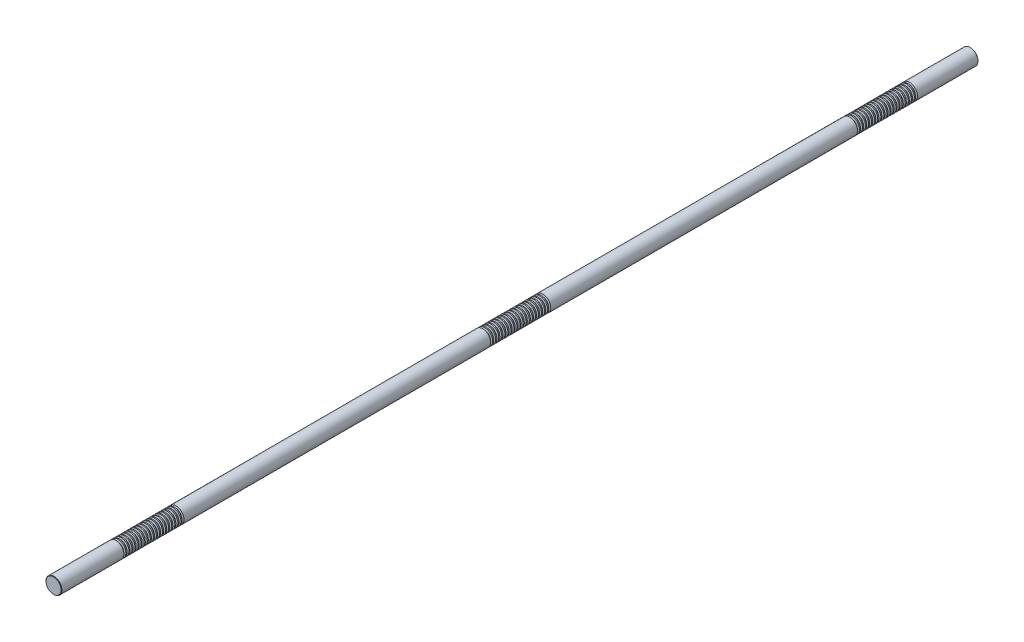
SolidWorks part; units mm, degrees
ref_plane "Front Plane" through (0, 0, 0) normal (0, 0, 1) x (1, 0, 0)
ref_plane "Top Plane" through (0, 0, 0) normal (0, 1, 0) x (1, 0, 0)
ref_plane "Right Plane" through (0, 0, 0) normal (1, 0, 0) x (0, 0, -1)
sketch "Sketch1" plane through (0, 0, 0) normal (0, 0, 1) x (1, 0, 0)
  circle A0 centre (0, 0) radius 13
  dimension "D1" = 26
extrude "Boss-Extrude1" add sketch "Sketch1" along normal mid plane 1500
chamfer "Chamfer1" distance 0.65 angle 45 2 edges at (13, 0, -750) (13, 0, 750)
sketch "Sketch2" plane through (0, 0, 0) normal (1, 0, 0) x (0, 0, -1)
  line L0 (650.3684, 13) -> (647.1316, 13)
  line L1 (749.35, 13) -> (-749.35, 13) construction
  line L2 (647.1316, 13) -> (647.8684, 10.25)
  line L3 (647.8684, 10.25) -> (649.6316, 10.25)
  line L4 (649.6316, 10.25) -> (650.3684, 13)
  line L5 (750, -12.35) -> (750, 12.35) construction
  point P4 (648.75, 13)
  point P7 (648.75, 10.25)
  point P8 (650, 11.625)
  point P9 (647.5, 11.625)
  dimension "D1" = 2.5
  dimension "D2" = 100
  dimension "D3" = 2.75
  dimension "D4" = 30
revolve "Cut-Revolve1" cut sketch "Sketch2" angle 360 about axis through (0, 0, 750) along (0, 0, -1)
pattern_linear "LPattern1" count 20 spacing 5 along (0, 0, 1) of "Cut-Revolve1"
pattern_linear "LPattern2" count 3 spacing 600 along (0, 0, 1) of "Cut-Revolve1", "LPattern1"
